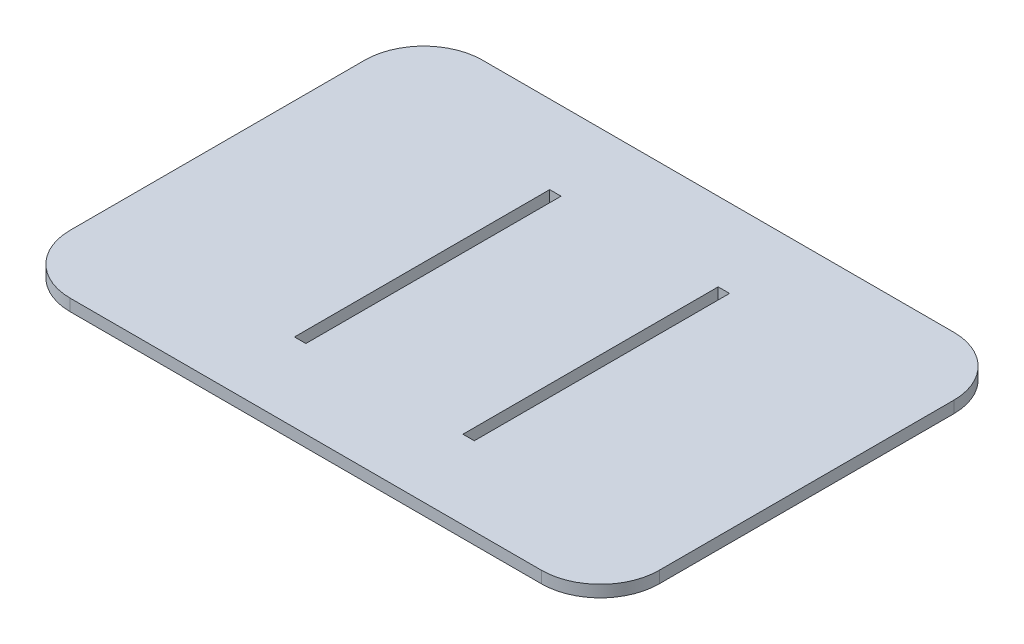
SolidWorks part; units mm, degrees
ref_plane "Plan de face" through (0, 0, 0) normal (0, 0, 1) x (1, 0, 0)
ref_plane "Plan de dessus" through (0, 0, 0) normal (0, 1, 0) x (1, 0, 0)
ref_plane "Plan de droite" through (0, 0, 0) normal (1, 0, 0) x (0, 0, -1)
sketch "Esquisse1" plane through (0, 0, 0) normal (0, 1, 0) x (1, 0, 0)
  line L0 (-20, 20) -> (-22.9, 20)
  line L1 (-60, -65) -> (60, -65)
  line L2 (-75, -50) -> (-75, 25)
  line L3 (-60, 40) -> (60, 40)
  line L4 (75, -50) -> (75, 25)
  line L5 (-22.9, 20) -> (-22.9, -45)
  line L6 (-22.9, -45) -> (-20, -45)
  line L8 (-20, 20) -> (-20, -45)
  line L11 (0, 0) -> (0, 34.7965) construction
  line L12 (22.9, -45) -> (20, -45)
  line L13 (22.9, 20) -> (22.9, -45)
  line L14 (20, 20) -> (20, -45)
  line L15 (20, 20) -> (22.9, 20)
  arc A0 (-75, -50) -> (-60, -65) centre (-60, -50) ccw
  arc A1 (60, -65) -> (75, -50) centre (60, -50) ccw
  arc A2 (75, 25) -> (60, 40) centre (60, 25) ccw
  arc A3 (-75, 25) -> (-60, 40) centre (-60, 25) cw
  point P0 (0, 0)
  point P18 (0, 0)
  dimension "D3" = 15
  dimension "D1" = 65
  dimension "D2" = 20
  dimension "D4" = 2.9
  dimension "D5" = 20
  dimension "20" = 20
extrude "Boss.-Extru.1" add sketch "Esquisse1" along normal blind 3
